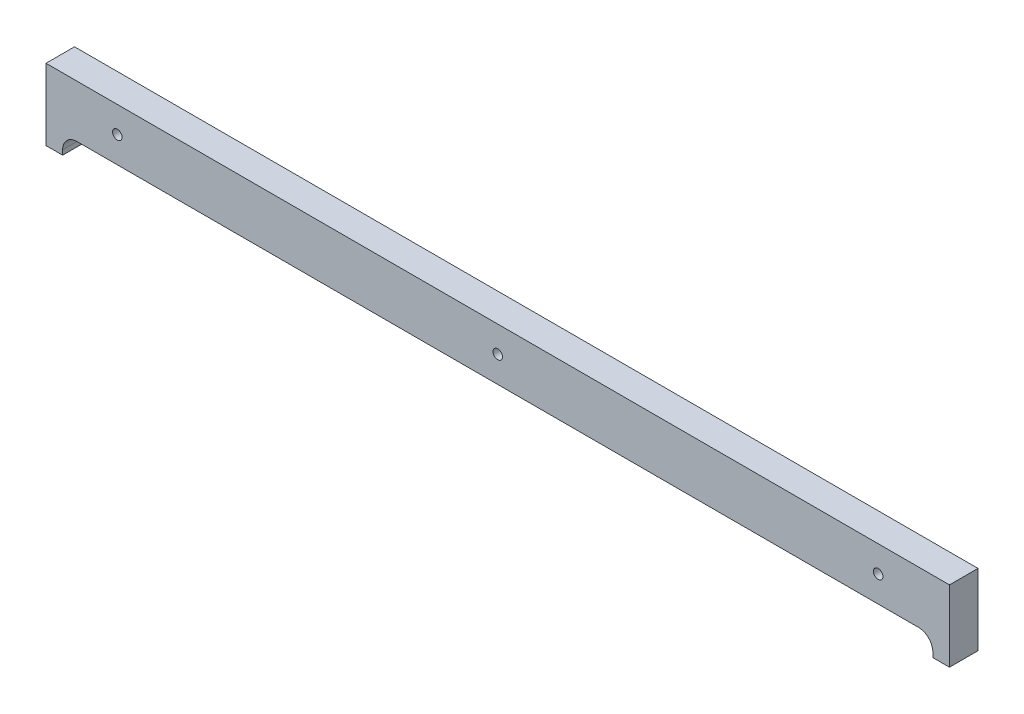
SolidWorks part; units mm, degrees
ref_plane "Plan de face" through (0, 0, 0) normal (0, 0, 1) x (1, 0, 0)
ref_plane "Plan de dessus" through (0, 0, 0) normal (0, 1, 0) x (1, 0, 0)
ref_plane "Plan de droite" through (0, 0, 0) normal (1, 0, 0) x (0, 0, -1)
sketch "Esquisse1" plane through (0, 0, 0) normal (0, 0, 1) x (1, 0, 0)
  line L1 (0, 0) -> (190, 0)
  line L2 (0, 0) -> (0, 15)
  line L3 (0, 15) -> (190, 15)
  line L4 (190, 0) -> (190, 15)
  dimension "D1" = 190
  dimension "D2" = 15
extrude "Extrusion1" add sketch "Esquisse1" along normal blind 6
sketch "Esquisse2" plane through (0, 0, 6) normal (0, 0, 1) x (1, 0, 0)
  line L0 (0, 15) -> (0, 0) construction
  line L1 (0, 0) -> (190, 0) construction
  line L2 (3.5, 0) -> (186.5, 0)
  line L3 (3.5, 0) -> (3.5, 1)
  line L4 (6.5, 4) -> (183.5, 4)
  line L6 (186.5, 0) -> (186.5, 1)
  line L7 (95, 15) -> (95, -15.148) construction
  line L8 (190, 15) -> (0, 15) construction
  arc A0 (6.5, 4) -> (3.5, 1) centre (6.5, 1) ccw
  arc A1 (186.5, 1) -> (183.5, 4) centre (183.5, 1) ccw
  dimension "D2" = 3
  dimension "D1" = 11
  dimension "D3" = 3.5
extrude "Enlèv. mat.-Extru.1" cut sketch "Esquisse2" against normal blind 4
sketch "Esquisse3" plane through (0, 0, 6) normal (0, 0, 1) x (1, 0, 0)
  line L0 (95, 15) -> (95, 4) construction
  line L1 (190, 15) -> (0, 15) construction
  line L2 (183.5, 4) -> (6.5, 4) construction
  line L3 (0, 9.5) -> (190, 9.5) construction
  line L4 (0, 15) -> (0, 0) construction
  line L5 (190, 0) -> (190, 15) construction
  circle A0 centre (95, 9.5) radius 1
  circle A1 centre (175, 9.5) radius 1
  circle A2 centre (15, 9.5) radius 1
  dimension "D2" = 15
  dimension "D3" = 2
  dimension "D1" = 5.5
extrude "Enlèv. mat.-Extru.2" cut sketch "Esquisse3" against normal through all
